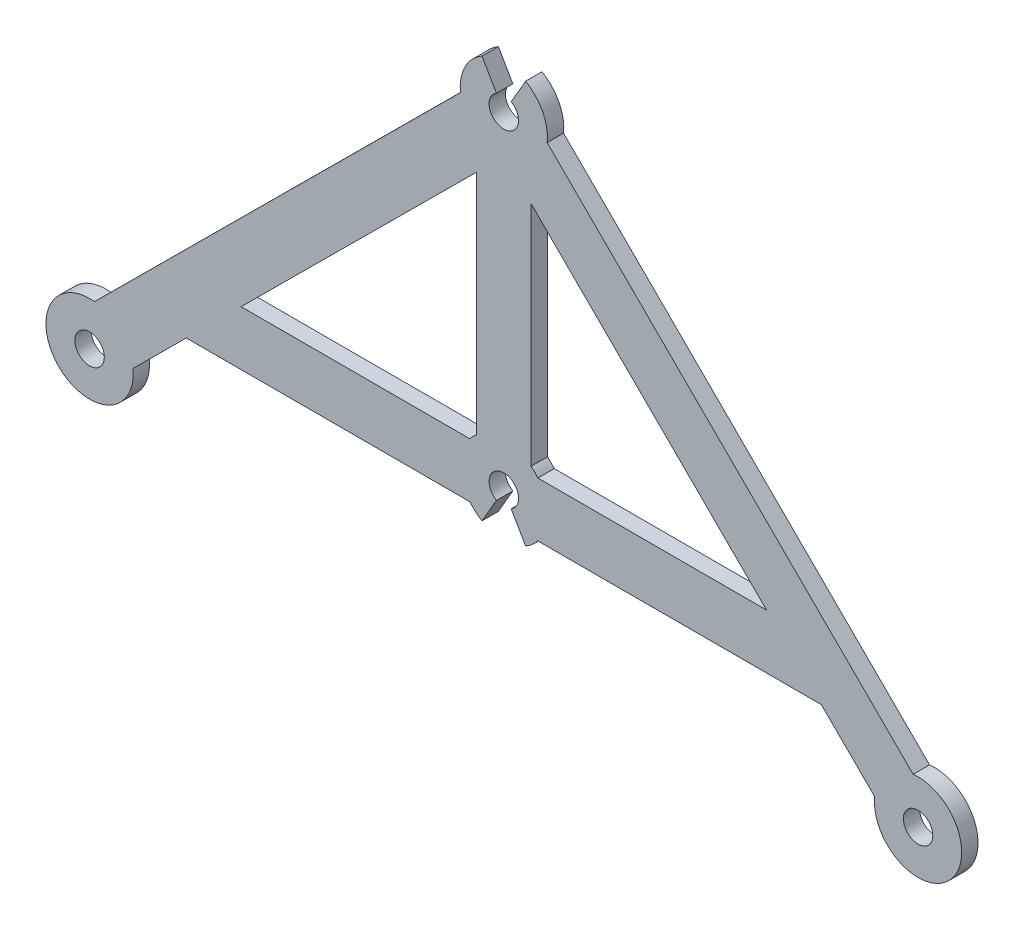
SolidWorks part; units mm, degrees
ref_plane "前视基准面" through (0, 0, 0) normal (0, 0, 1) x (1, 0, 0)
ref_plane "上视基准面" through (0, 0, 0) normal (0, 1, 0) x (1, 0, 0)
ref_plane "右视基准面" through (0, 0, 0) normal (1, 0, 0) x (0, 0, -1)
other "Configuration Table"
sketch "草图1" plane through (0, 0, 0) normal (0, 0, 1) x (1, 0, 0)
  line L0 (0, 0) -> (0, -7.8) construction
  line L1 (0, -7.8) -> (-38, -7.8) construction
  line L2 (0, 0) -> (0, 30) construction
  line L3 (0, 0) -> (-38, -7.8) construction
  line L4 (0, -7.8) -> (38, -7.8) construction
  line L5 (0, 0) -> (38, -7.8) construction
  line L6 (-0.675, -1.1691) -> (-2, -3.4641)
  line L7 (0.675, -1.1691) -> (2, -3.4641)
  line L8 (-0.675, -1.1691) -> (0, 0) construction
  line L9 (0, 0) -> (0.675, -1.1691) construction
  line L10 (0, 0) -> (2.5, 0) construction
  line L11 (2.5, 3.1225) -> (2.5, 23.9869)
  line L12 (2.5, 30) -> (0, 30) construction
  line L13 (0, 30) -> (-2.5, 30) construction
  line L14 (-2.5, 23.9869) -> (-2.5, 3.1225)
  line L15 (-2.5, 0) -> (0, 0) construction
  line L16 (2.5, 26.8775) -> (2.5, 30) construction
  line L17 (-2.5, 26.8775) -> (-2.5, 30) construction
  line L18 (-0.675, 31.1691) -> (-2, 33.4641)
  line L19 (0.675, 31.1691) -> (2, 33.4641)
  line L20 (0.675, 31.1691) -> (0, 30) construction
  line L21 (0, 30) -> (-0.675, 31.1691) construction
  line L22 (0, 30) -> (-38, -7.8) construction
  line L23 (0, 30) -> (38, -7.8) construction
  line L24 (0, 30) -> (1.7631, 28.2276) construction
  line L25 (0, 30) -> (-1.7631, 31.7724) construction
  line L26 (-38, -7.8) -> (-39.7631, -6.0276)
  line L27 (-38, -7.8) -> (-36.2369, -9.5724) construction
  line L28 (-3.9769, 29.5703) -> (-37.5493, -3.8255)
  line L29 (-34.0231, -7.3703) -> (-29.1271, -2.5)
  line L30 (-37.5493, -3.8255) -> (-39.7631, -6.0276) construction
  line L31 (-34.0231, -7.3703) -> (-36.2369, -9.5724) construction
  line L32 (-1.7631, 31.7724) -> (-3.9769, 29.5703) construction
  line L33 (1.7631, 28.2276) -> (-2.5, 23.9869) construction
  line L34 (-2.5, 26.8775) -> (-2.5, 23.9869) construction
  line L35 (0, 0) -> (0, 2.5) construction
  line L36 (0, 0) -> (0, -2.5) construction
  line L37 (-3.1225, 2.5) -> (-24.1006, 2.5)
  line L38 (-3.1225, -2.5) -> (-29.1271, -2.5)
  line L39 (-24.1006, 2.5) -> (-2.5, 23.9869)
  line L40 (0, -2.5) -> (-3.1225, -2.5) construction
  line L41 (0, 2.5) -> (-3.1225, 2.5) construction
  line L42 (0, 30) -> (-1.7631, 28.2276) construction
  line L43 (0, 30) -> (1.7631, 31.7724) construction
  line L44 (38, -7.8) -> (39.7631, -6.0276) construction
  line L45 (38, -7.8) -> (36.2369, -9.5724) construction
  line L46 (37.5493, -3.8255) -> (3.9769, 29.5703)
  line L47 (2.5, 23.9869) -> (24.1006, 2.5)
  line L48 (34.0231, -7.3703) -> (36.2369, -9.5724) construction
  line L49 (37.5493, -3.8255) -> (39.7631, -6.0276) construction
  line L50 (3.9769, 29.5703) -> (1.7631, 31.7724) construction
  line L51 (-1.7631, 28.2276) -> (0, 26.4738) construction
  line L52 (3.1225, 2.5) -> (24.1006, 2.5)
  line L53 (0, 2.5) -> (3.1225, 2.5) construction
  line L54 (29.1271, -2.5) -> (34.0231, -7.3703)
  line L55 (3.1225, -2.5) -> (29.1271, -2.5)
  line L56 (0, -2.5) -> (3.1225, -2.5) construction
  line L57 (2.5, 26.8775) -> (2.5, 23.9869) construction
  line L58 (0, 26.4738) -> (2.5, 23.9869) construction
  arc A0 (0.675, -1.1691) -> (-0.675, -1.1691) centre (0, 0) ccw
  arc A1 (2, -3.4641) -> (3.1225, -2.5) centre (0, 0) ccw
  circle A2 centre (-38, -7.8) radius 1.35
  arc A3 (-37.5493, -3.8255) -> (-34.0231, -7.3703) centre (-38, -7.8) ccw
  circle A4 centre (38, -7.8) radius 1.35
  arc A5 (34.0231, -7.3703) -> (37.5493, -3.8255) centre (38, -7.8) ccw
  arc A6 (-0.675, 31.1691) -> (0.675, 31.1691) centre (0, 30) ccw
  arc A8 (-2.5, 3.1225) -> (-3.1225, 2.5) centre (0, 0) ccw
  arc A9 (-2, 33.4641) -> (-3.9769, 29.5703) centre (0, 30) ccw
  arc A10 (-3.1225, -2.5) -> (-2, -3.4641) centre (0, 0) ccw
  arc A11 (3.9769, 29.5703) -> (2, 33.4641) centre (0, 30) ccw
  arc A12 (3.1225, 2.5) -> (2.5, 3.1225) centre (0, 0) ccw
  dimension "D4" = 2.7
  dimension "D5" = 8
  dimension "D6" = 38
  dimension "D7" = 2.7
  dimension "D8" = 4
  dimension "D9" = 2.7
  dimension "D10" = 8
  dimension "D11" = 2.7
  dimension "D12" = 8
  dimension "D43" = 4
  dimension "D1" = 7.8
  dimension "D2" = 38
  dimension "D3" = 30
  dimension "D13" = 30
  dimension "D14" = 30
  dimension "D15" = 30
  dimension "D16" = 2.5
  dimension "D17" = 2.5
  dimension "D18" = 150
  dimension "D19" = 150
  dimension "D20" = 150
  dimension "D21" = 2.5
  dimension "D22" = 2.5
  dimension "D23" = 90
  dimension "D24" = 90
  dimension "D25" = 2.5
  dimension "D26" = 2.5
  dimension "D27" = 90
  dimension "D28" = 90
  dimension "D29" = 90
  dimension "D30" = 2.5
  dimension "D31" = 2.5
  dimension "D32" = 2.5
  dimension "D33" = 2.5
  dimension "D34" = 90
  dimension "D35" = 90
  dimension "D36" = 2.5
  dimension "D37" = 2.5
  dimension "D38" = 90
  dimension "D39" = 90
  dimension "D40" = 90
  dimension "D41" = 90
  dimension "D42" = 90
extrude "凸台-拉伸1" add sketch "草图1" along normal blind 1.5
